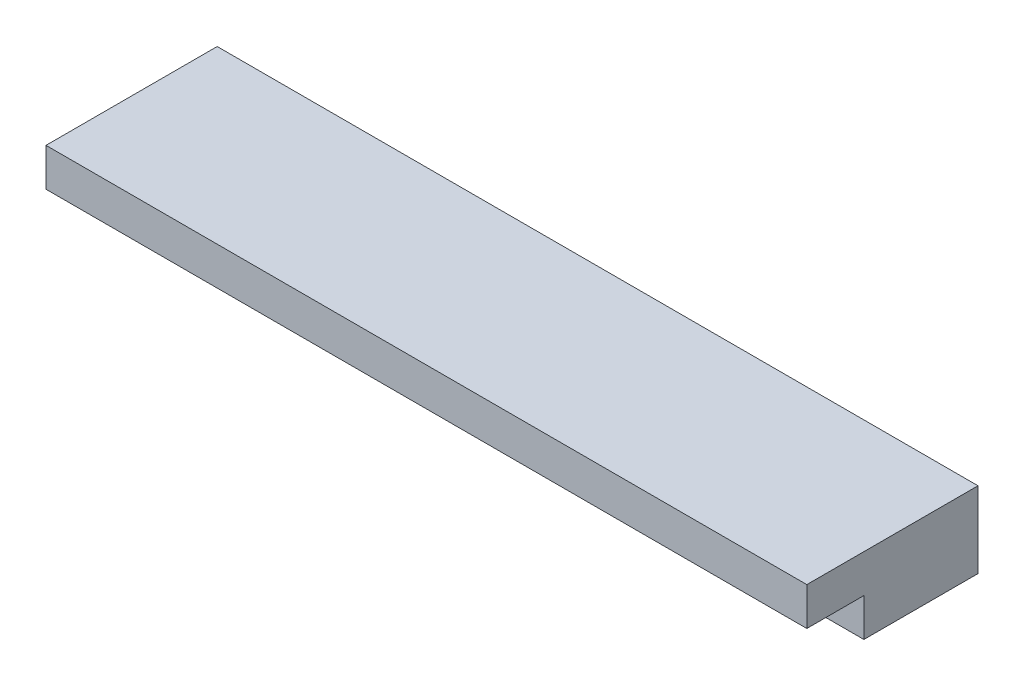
SolidWorks part; units mm, degrees
ref_plane "Спереди" through (0, 0, 0) normal (0, 0, 1) x (1, 0, 0)
ref_plane "Сверху" through (0, 0, 0) normal (0, 1, 0) x (1, 0, 0)
ref_plane "Справа" through (0, 0, 0) normal (1, 0, 0) x (0, 0, -1)
sketch "Эскиз1" plane through (0, 0, 0) normal (1, 0, 0) x (0, 0, -1)
  line L0 (0, 0) -> (0, 2)
  line L1 (0, 2) -> (-3, 2)
  line L2 (-3, 2) -> (-3, 4)
  line L3 (-3, 4) -> (6, 4)
  line L4 (6, 4) -> (6, 0)
  line L5 (6, 0) -> (0, 0)
  dimension "D1" = 2
  dimension "D2" = 2
  dimension "D3" = 6
  dimension "D4" = 3
extrude "Бобышка-Вытянуть1" add sketch "Эскиз1" along normal mid plane 40
